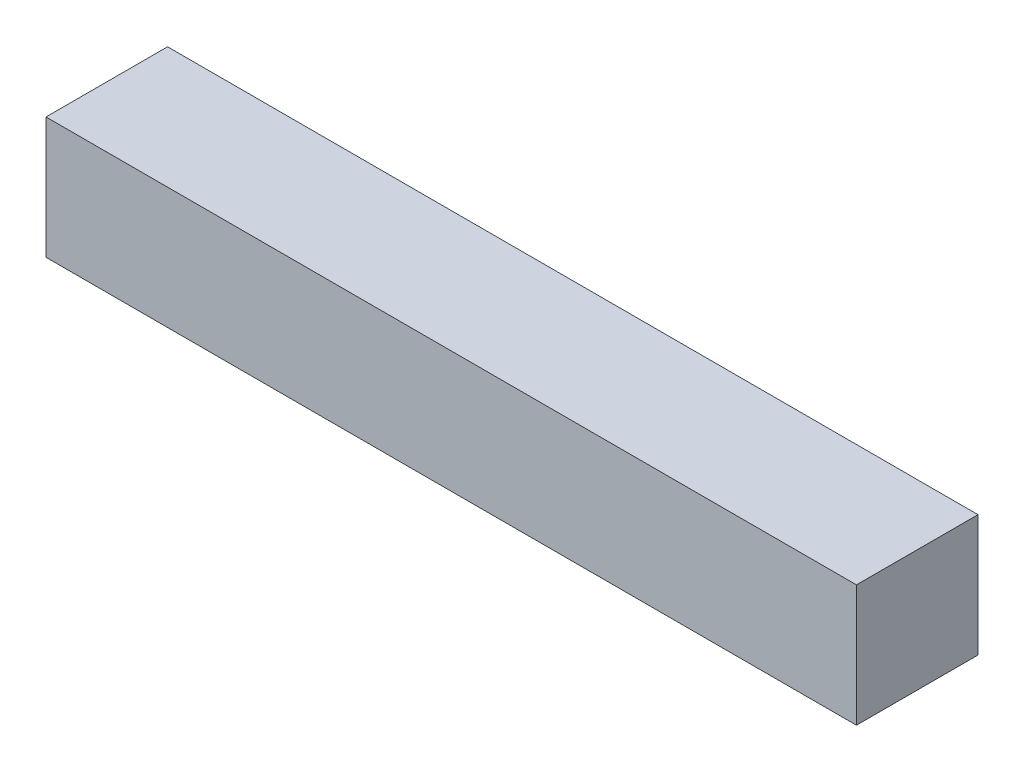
SolidWorks part; units mm, degrees
ref_plane "Спереди" through (0, 0, 0) normal (0, 0, 1) x (1, 0, 0)
ref_plane "Сверху" through (0, 0, 0) normal (0, 1, 0) x (1, 0, 0)
ref_plane "Справа" through (0, 0, 0) normal (1, 0, 0) x (0, 0, -1)
sketch "Эскиз1" plane through (0, 0, 0) normal (0, 1, 0) x (1, 0, 0)
  line L0 (-219.6667, -1345.7718) -> (-219.6667, -1495.7718)
  line L1 (780.3333, -1345.7718) -> (780.3333, -1495.7718)
  line L30 (-219.6667, -1345.7718) -> (780.3333, -1345.7718)
  line L35 (-219.6667, -1495.7718) -> (780.3333, -1495.7718)
  dimension "D3" = 150
  dimension "D1" = 1000
extrude "Вытянуть1" add sketch "Эскиз1" along normal blind 150
